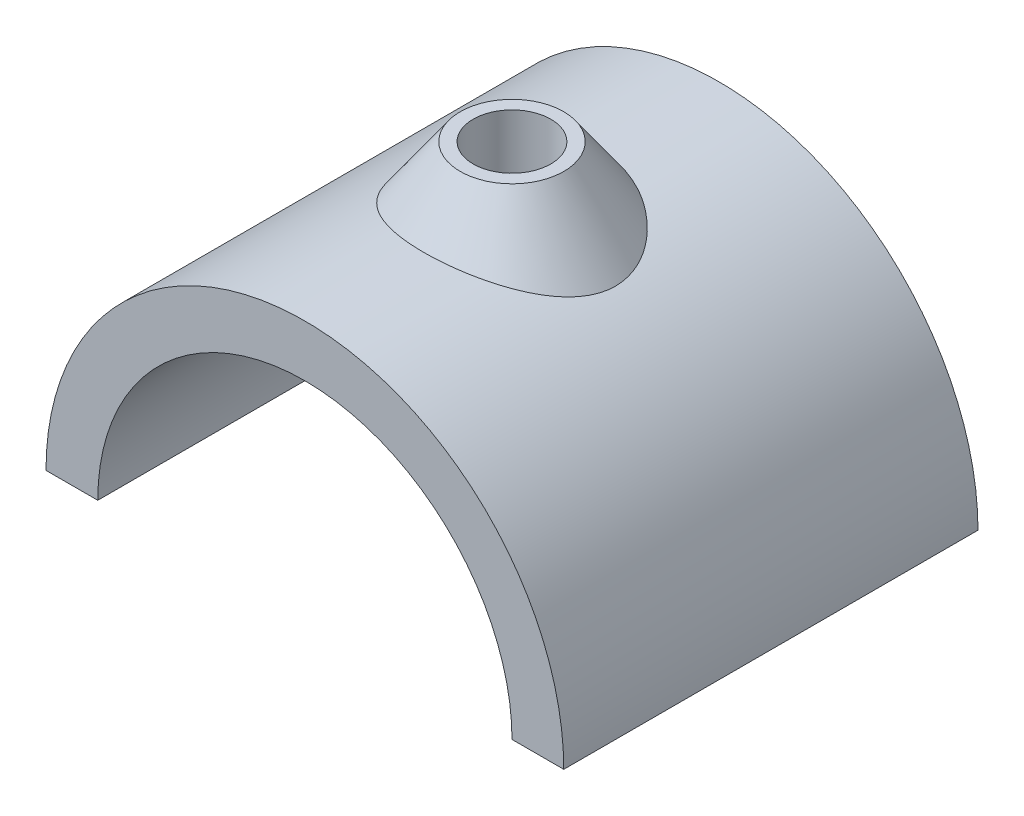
SolidWorks part; units mm, degrees
ref_plane "前视基准面" through (0, 0, 0) normal (0, 0, 1) x (1, 0, 0)
ref_plane "上视基准面" through (0, 0, 0) normal (0, 1, 0) x (1, 0, 0)
ref_plane "右视基准面" through (0, 0, 0) normal (1, 0, 0) x (0, 0, -1)
sketch "Sketch1" plane through (0, 0, 0) normal (0, 0, 1) x (1, 0, 0)
  line L0 (-75.0687, 0) -> (65.4342, 0) construction
  line L1 (50, 0) -> (40, 0)
  line L2 (-40, 0) -> (-50, 0)
  arc A0 (-50, 0) -> (50, 0) centre (0, 0) cw
  arc A1 (-40, 0) -> (40, 0) centre (0, 0) cw
  dimension "D1" = 40
  dimension "D2" = 50
extrude "Extrude1" add sketch "Sketch1" along normal mid plane 80
sketch "草图1" plane through (0, 0, 0) normal (0, 0, 1) x (1, 0, 0)
  line L0 (0, 0) -> (0, 66.8263) construction
  line L1 (0, 60) -> (-10, 60)
  line L2 (-10, 60) -> (-20, 45.8258)
  line L3 (0, 60) -> (0, 50)
  arc A0 (50, 0) -> (-50, 0) centre (0, 0) ccw construction
  arc A1 (-20, 45.8258) -> (0, 50) centre (0, 0) cw
  dimension "D1" = 60
  dimension "D2" = 10
  dimension "D3" = 20
revolve "旋转1" add sketch "草图1" angle 360 about L0
sketch "草图2" plane through (0, 60, 0) normal (0, 1, 0) x (1, 0, 0)
  circle A0 centre (0, 0) radius 7.5
  dimension "D1" = 15
extrude "切除-拉伸1" cut sketch "草图2" against normal through all
